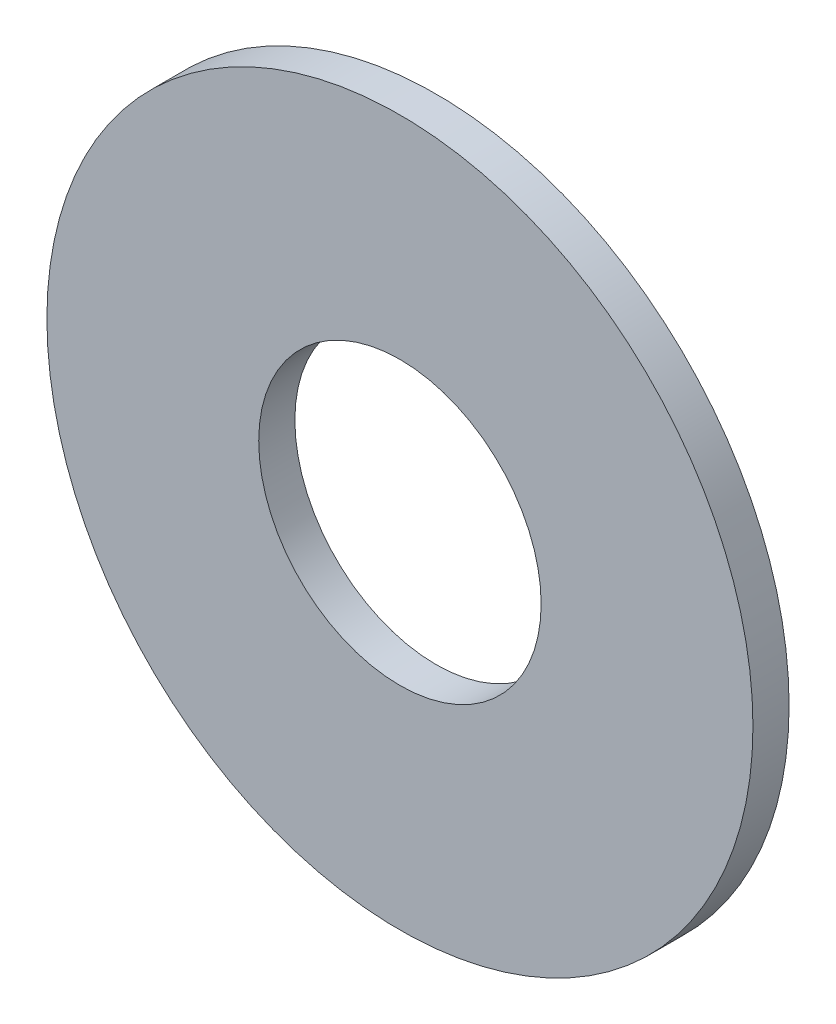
SolidWorks part; units mm, degrees
ref_plane "Front Plane" through (0, 0, 0) normal (0, 0, 1) x (1, 0, 0)
ref_plane "Top Plane" through (0, 0, 0) normal (0, 1, 0) x (1, 0, 0)
ref_plane "Right Plane" through (0, 0, 0) normal (1, 0, 0) x (0, 0, -1)
sketch "Sketch2" plane through (0, 0, 0) normal (0, 0, 1) x (1, 0, 0)
  circle A0 centre (0, 0) radius 7.9375
  circle A1 centre (0, 0) radius 3.175
  dimension "D1" = 15.875
  dimension "D2" = 6.35
extrude "Boss-Extrude1" add sketch "Sketch2" along normal blind 0.8128
